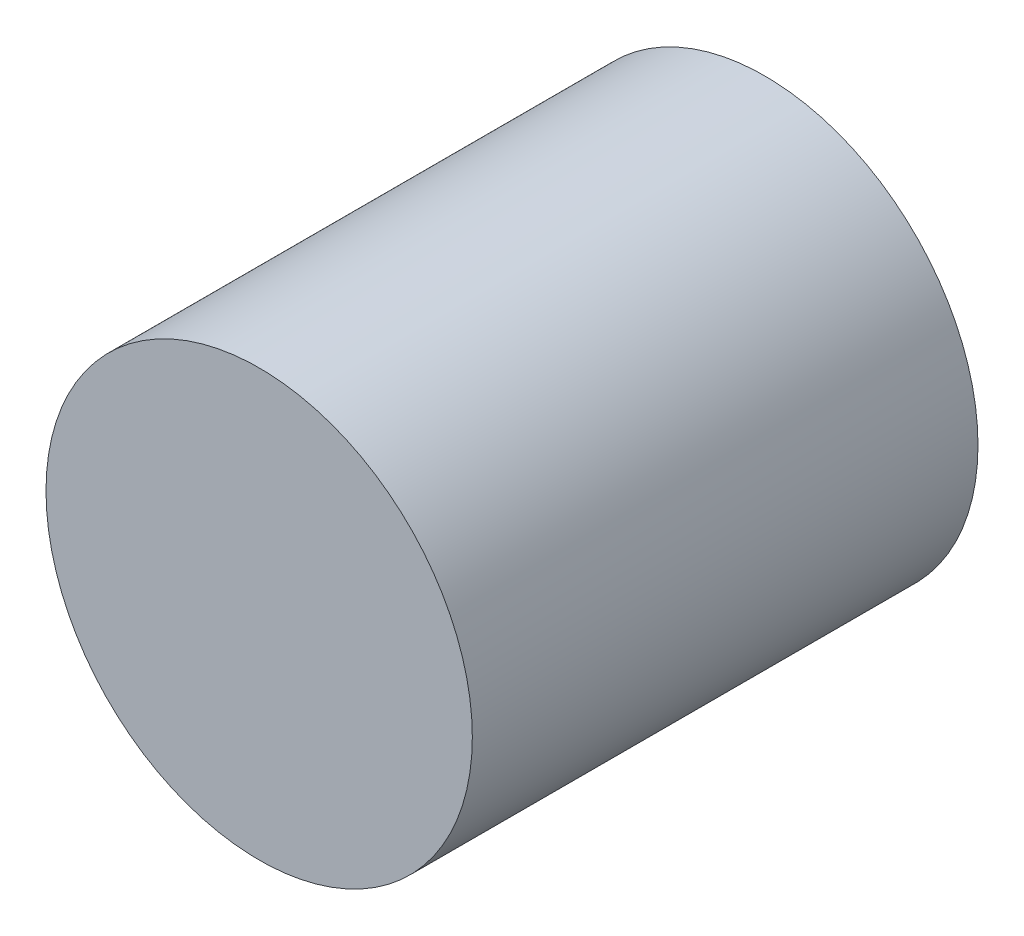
SolidWorks part; units mm, degrees
ref_plane "Front Plane" through (0, 0, 0) normal (0, 0, 1) x (1, 0, 0)
ref_plane "Top Plane" through (0, 0, 0) normal (0, 1, 0) x (1, 0, 0)
ref_plane "Right Plane" through (0, 0, 0) normal (1, 0, 0) x (0, 0, -1)
sketch "Sketch1" plane through (0, 0, 0) normal (0, 0, 1) x (1, 0, 0)
  circle A0 centre (0, 0) radius 21.5
  dimension "D1" = 43
extrude "Boss-Extrude1" add sketch "Sketch1" along normal blind 51
